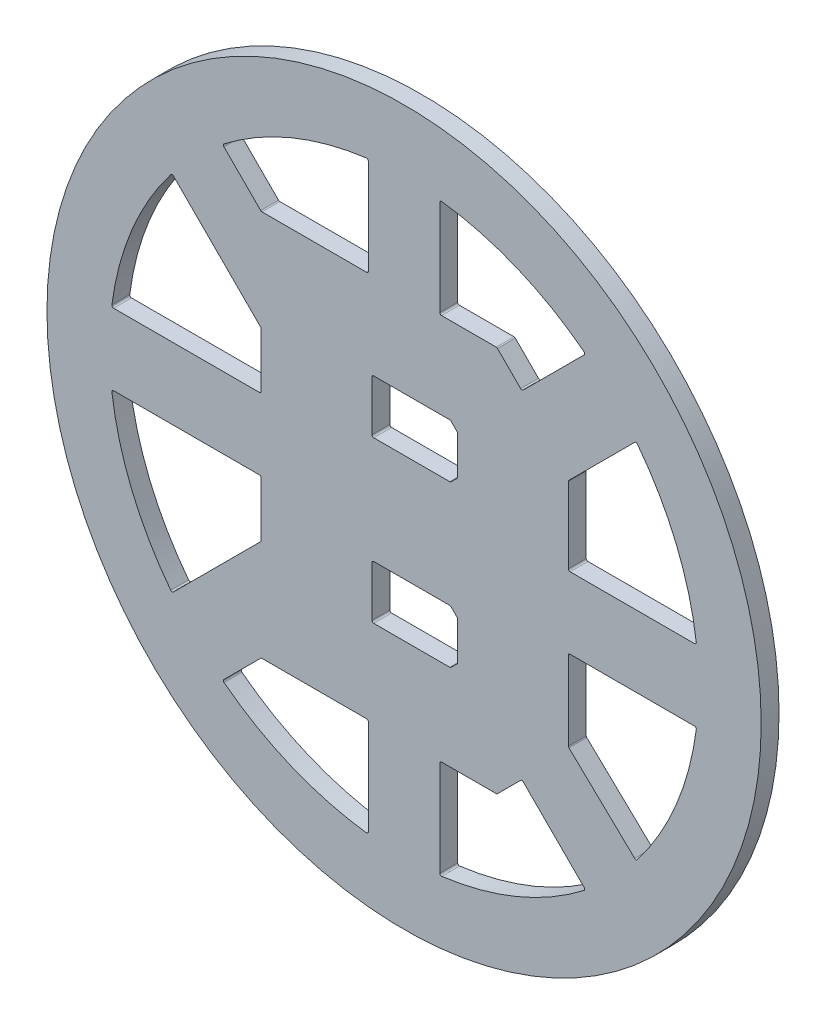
SolidWorks part; units mm, degrees
ref_plane "Front Plane" through (0, 0, 0) normal (0, 0, 1) x (1, 0, 0)
ref_plane "Top Plane" through (0, 0, 0) normal (0, 1, 0) x (1, 0, 0)
ref_plane "Right Plane" through (0, 0, 0) normal (1, 0, 0) x (0, 0, -1)
sketch "Sketch1" plane through (0, 0, 0) normal (0, 0, 1) x (1, 0, 0)
  line L0 (0, 0) -> (0, 100) construction
  line L1 (0, 0) -> (-70.7107, 70.7107) construction
  line L2 (0, 0) -> (10, 10) construction
  line L3 (0, 0) -> (-100, 0) construction
  line L4 (0, 0) -> (100, 0) construction
  line L5 (46, 10) -> (81.8917, 10)
  line L6 (99.4987, 10) -> (100, 10)
  line L7 (46, 31.8579) -> (64.9772, 50.8351)
  line L9 (-77.4273, 63.2852) -> (-77.7817, 63.6396)
  line L10 (-40, 25.8579) -> (-64.9772, 50.8351)
  line L11 (-40, 10) -> (-81.8917, 10)
  line L12 (-99.4987, 10) -> (-100, 10)
  line L13 (-7.0711, -7.0711) -> (-77.7817, 63.6396) construction
  line L14 (58.3363, -58.3363) -> (70.7107, -70.7107) construction
  line L15 (-63.2852, 77.4273) -> (-63.6396, 77.7817)
  line L16 (0, 0) -> (10, -10) construction
  line L17 (-10, 99.4987) -> (-10, 100)
  line L19 (10, 99.4987) -> (10, 100)
  line L20 (77.4273, -63.2852) -> (77.7817, -63.6396)
  line L21 (63.2852, 77.4273) -> (63.6396, 77.7817)
  line L22 (63.2852, -77.4273) -> (63.6396, -77.7817)
  line L23 (77.4273, 63.2852) -> (77.7817, 63.6396)
  line L24 (7.0711, -7.0711) -> (77.7817, 63.6396) construction
  line L25 (58.3363, 58.3363) -> (70.7107, 70.7107) construction
  line L26 (0, 0) -> (70.7107, 70.7107) construction
  line L27 (-40, 54.1421) -> (-50.8351, 64.9772)
  line L28 (-10, 54.14) -> (-10, 81.8917)
  line L31 (46, -32.7179) -> (64.9772, -50.8351)
  line L32 (99.4987, -10) -> (100, -10)
  line L33 (46, -10) -> (81.8917, -10)
  line L34 (-10, -54.14) -> (-10, -81.8917)
  line L35 (-40, -54.1421) -> (-50.8351, -64.9772)
  line L36 (-63.2852, -77.4273) -> (-63.6396, -77.7817)
  line L37 (-99.4987, -10) -> (-100, -10)
  line L38 (-40, -10) -> (-81.8917, -10)
  line L39 (-40, -25.8579) -> (-64.9772, -50.8351)
  line L40 (-77.4273, -63.2852) -> (-77.7817, -63.6396)
  line L41 (26, 54.14) -> (32.9989, 47.1411)
  line L42 (-40, -54.14) -> (-10, -54.14)
  line L43 (-40, -54.14) -> (-40, -54.1421)
  line L44 (-40, 54.14) -> (-10, 54.14)
  line L45 (46, -32.7179) -> (46, -10)
  line L46 (26, -54.14) -> (32.9989, -47.1411)
  line L47 (13, 30) -> (15, 28)
  line L48 (-9, 15) -> (13, 15)
  line L49 (-9, 15) -> (-9, 30)
  line L50 (-9, 30) -> (13, 30)
  line L51 (15, 17) -> (15, 28)
  line L52 (13, 15) -> (15, 17)
  line L53 (-9, -30) -> (13, -30)
  line L54 (13, -30) -> (15, -28)
  line L55 (15, -17) -> (15, -28)
  line L56 (13, -15) -> (15, -17)
  line L57 (-9, -15) -> (13, -15)
  line L58 (-9, -15) -> (-9, -30)
  line L59 (10, -54.14) -> (10, -81.8917)
  line L60 (32.9989, -47.1411) -> (50.8351, -64.9772)
  line L61 (32.9989, 47.1411) -> (50.8351, 64.9772)
  line L62 (10, 54.14) -> (10, 81.8917)
  line L63 (10, 54.14) -> (26, 54.14)
  line L64 (-40, -25.8579) -> (-40, -10)
  line L65 (-40, 10) -> (-40, 25.8579)
  line L66 (-40, 54.1421) -> (-40, 54.14)
  line L67 (46, 10) -> (46, 31.8579)
  line L68 (10, -54.14) -> (26, -54.14)
  circle A0 centre (0, 0) radius 100
  arc A1 (50.8351, 64.9772) -> (10, 81.8917) centre (0, 0) ccw
  arc A2 (-10, 81.8917) -> (-50.8351, 64.9772) centre (0, 0) ccw
  arc A3 (-64.9772, 50.8351) -> (-81.8917, 10) centre (0, 0) ccw
  arc A4 (81.8917, -10) -> (64.9772, -50.8351) centre (0, 0) cw
  arc A5 (81.8917, 10) -> (64.9772, 50.8351) centre (0, 0) ccw
  arc A6 (50.8351, -64.9772) -> (10, -81.8917) centre (0, 0) cw
  arc A7 (-64.9772, -50.8351) -> (-81.8917, -10) centre (0, 0) cw
  arc A8 (-10, -81.8917) -> (-50.8351, -64.9772) centre (0, 0) cw
  point P68 (46, 54.14)
  point P70 (46, -54.14)
  point P76 (15, 30)
  point P78 (15, 15)
  dimension "D1" = 200
  dimension "D2" = 165
  dimension "D3" = 45
  dimension "D4" = 45
  dimension "D7" = 86
  dimension "D8" = 40
  dimension "D9" = 108.28
  dimension "D10" = 54.14
  dimension "D11" = 20
  dimension "D13" = 20
  dimension "D15" = 15
  dimension "D16" = 15
  dimension "D17" = 24
  dimension "D18" = 9
  dimension "D5" = 10
  dimension "D6" = 10
extrude "Boss-Extrude1" add sketch "Sketch1" along normal blind 5 contours A0 A5 L5 L67 L7 A3 L10 L65 L11 A2 L28 L44 L66 L27 A1 L61 L41 L63 L62 L52 L48 L49 L50 L47 L51 L58 L57 L56 L55 L54 L53
fillet "Fillet1" radius 0.5 10 edges at (-40, 54.1421, 2.5) (81.8917, 10, 2.5) (46, 31.8579, 2.5) (-40, 25.8579, 2.5) (-10, 54.14, 2.5) (64.9772, 50.8351, 2.5) (-40, 10, 2.5) (-81.8917, 10, 2.5) (-64.9772, 50.8351, 2.5) (-10, 81.8917, 2.5)
fillet "Fillet2" radius 0.5 3 edges at (-40, -54.14, 2.5) (-10, -54.14, 2.5) (46, 10, 2.5)
fillet "Fillet3" radius 0.5 35 edges at (-40, -54.1421, 2.5) (-50.8351, 64.9772, 2.5) (-40, 54.14, 2.5) (26, 54.14, 2.5) (10, 54.14, 2.5) (50.8351, 64.9772, 2.5) (32.9989, 47.1411, 2.5) (10, 81.8917, 2.5) (-9, -15, 2.5) (13, -15, 2.5) (13, 30, 2.5) (15, 28, 2.5) (15, 17, 2.5) (-9, 30, 2.5) (-9, 15, 2.5) (13, 15, 2.5) (-9, -30, 2.5) (15, -17, 2.5) (15, -28, 2.5) (13, -30, 2.5) (46, -10, 2.5) (64.9772, -50.8351, 2.5) (81.8917, -10, 2.5) (46, -32.7179, 2.5) (50.8351, -64.9772, 2.5) (10, -54.14, 2.5) (-40, -10, 2.5) (32.9989, -47.1411, 2.5) (10, -81.8917, 2.5) (26, -54.14, 2.5) (-81.8917, -10, 2.5) (-64.9772, -50.8351, 2.5) (-10, -81.8917, 2.5) (-50.8351, -64.9772, 2.5) (-40, -25.8579, 2.5)
